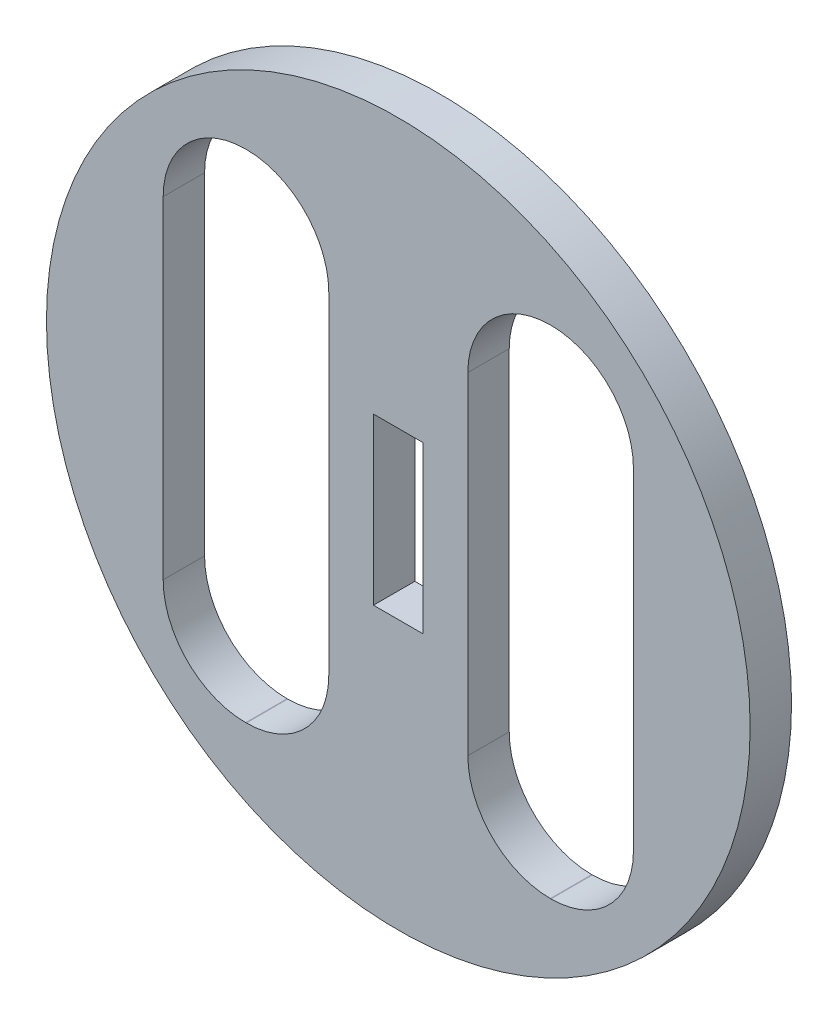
SolidWorks part; units mm, degrees
ref_plane "Front Plane" through (0, 0, 0) normal (0, 0, 1) x (1, 0, 0)
ref_plane "Top Plane" through (0, 0, 0) normal (0, 1, 0) x (1, 0, 0)
ref_plane "Right Plane" through (0, 0, 0) normal (1, 0, 0) x (0, 0, -1)
sketch "Sketch1" plane through (0, 0, 0) normal (0, 0, 1) x (1, 0, 0)
  circle A0 centre (0, 0) radius 26.9875
  dimension "D1" = 53.975
extrude "Extrude1" add sketch "Sketch1" along normal blind 3.175
sketch "Sketch2" plane through (0, 0, 0) normal (0, 0, 1) x (1, 0, 0)
  line L0 (0, -29.206) -> (0, 29.28) construction
  line L1 (27.2748, 0) -> (-29.4666, 0) construction
  line L2 (-11.7094, 19.05) -> (-11.6586, 19.05)
  line L3 (-18.034, 12.7254) -> (-18.034, -12.7254)
  line L4 (-11.7094, -19.05) -> (-11.6586, -19.05)
  line L5 (-5.334, 12.7254) -> (-5.334, -12.7254)
  line L6 (11.6586, 19.05) -> (11.7094, 19.05)
  line L7 (5.334, 12.7254) -> (5.334, -12.7254)
  line L8 (11.6586, -19.05) -> (11.7094, -19.05)
  line L9 (18.034, 12.7254) -> (18.034, -12.7254)
  arc A0 (-18.034, 12.7254) -> (-11.7094, 19.05) centre (-11.7094, 12.7254) cw
  arc A1 (-5.334, 12.7254) -> (-11.6586, 19.05) centre (-11.6586, 12.7254) ccw
  arc A2 (-11.7094, -19.05) -> (-18.034, -12.7254) centre (-11.7094, -12.7254) cw
  arc A3 (-11.6586, -19.05) -> (-5.334, -12.7254) centre (-11.6586, -12.7254) ccw
  arc A4 (5.334, 12.7254) -> (11.6586, 19.05) centre (11.6586, 12.7254) cw
  arc A5 (18.034, 12.7254) -> (11.7094, 19.05) centre (11.7094, 12.7254) ccw
  arc A6 (11.7094, -19.05) -> (18.034, -12.7254) centre (11.7094, -12.7254) ccw
  arc A7 (5.334, -12.7254) -> (11.6586, -19.05) centre (11.6586, -12.7254) ccw
  point P15 (-18.034, 19.05)
  point P18 (-5.334, 19.05)
  point P21 (-18.034, -19.05)
  point P26 (5.334, 19.05)
  point P29 (18.034, 19.05)
  point P32 (18.034, -19.05)
  dimension "D5" = 5.334
  dimension "D9" = 6.3246
  dimension "D1" = 38.1
  dimension "D2" = 38.1
  dimension "D3" = 12.7
  dimension "D4" = 12.7
  dimension "D6" = 5.334
  dimension "D7" = 19.05
  dimension "D8" = 19.05
extrude "Cut-Extrude1" cut sketch "Sketch2" along normal through all
sketch "Sketch3" plane through (0, 0, 0) normal (0, 0, 1) x (1, 0, 0)
  line L0 (26.9875, 0) -> (-26.9875, 0) construction
  line L1 (-1.905, 6.35) -> (1.905, 6.35)
  line L2 (-1.905, 6.35) -> (-1.905, -6.35)
  line L3 (-1.905, -6.35) -> (1.905, -6.35)
  line L4 (1.905, 6.35) -> (1.905, -6.35)
  line L5 (0, -26.9875) -> (0, 27.133) construction
  circle A0 centre (0, 0) radius 26.9875 construction
  dimension "D1" = 3.81
  dimension "D2" = 12.7
  dimension "D3" = 6.35
  dimension "D4" = 1.905
extrude "Cut-Extrude2" cut sketch "Sketch3" along normal through all
